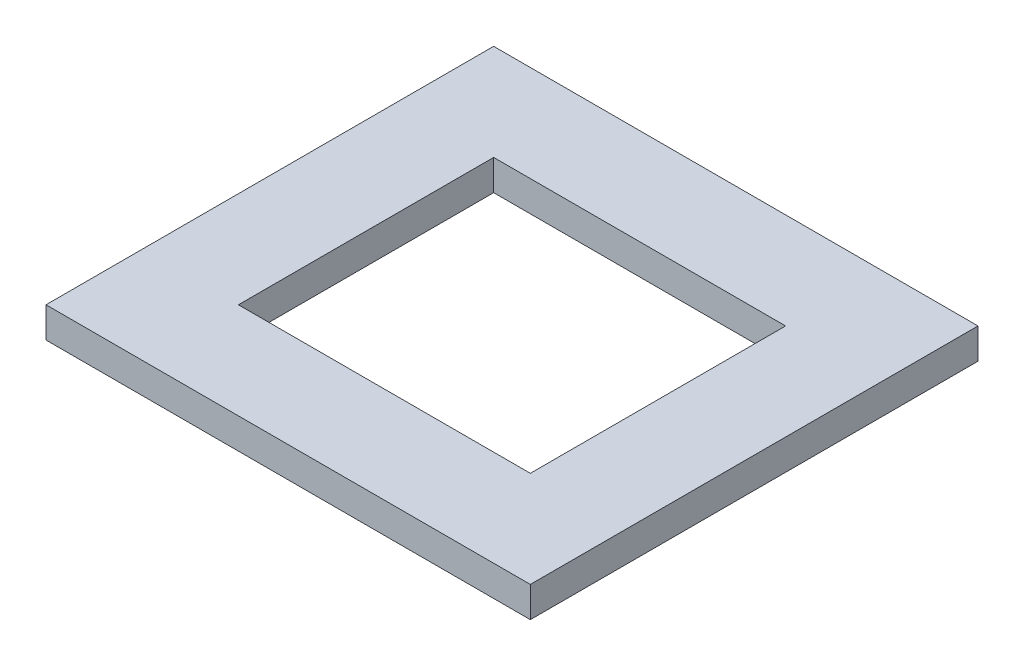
SolidWorks part; units mm, degrees
ref_plane "Front Plane" through (0, 0, 0) normal (0, 0, 1) x (1, 0, 0)
ref_plane "Top Plane" through (0, 0, 0) normal (0, 1, 0) x (1, 0, 0)
ref_plane "Right Plane" through (0, 0, 0) normal (1, 0, 0) x (0, 0, -1)
sketch "Sketch1" plane through (0, 0, 0) normal (0, 1, 0) x (1, 0, 0)
  line L1 (-68.265, 59.69) -> (68.265, 59.69)
  line L2 (-68.265, 59.69) -> (-68.265, -59.69)
  line L3 (-68.265, -59.69) -> (68.265, -59.69)
  line L4 (68.265, 59.69) -> (68.265, -59.69)
  line L5 (-68.265, 59.69) -> (68.265, -59.69) construction
  line L6 (-68.265, -59.69) -> (68.265, 59.69) construction
  line L7 (-113.265, 104.69) -> (113.265, 104.69)
  line L8 (-113.265, 104.69) -> (-113.265, -104.69)
  line L9 (-113.265, -104.69) -> (113.265, -104.69)
  line L10 (113.265, 104.69) -> (113.265, -104.69)
  line L11 (-113.265, 104.69) -> (113.265, -104.69) construction
  line L12 (-113.265, -104.69) -> (113.265, 104.69) construction
  point P0 (0, 0)
  point P6 (0, 0)
  dimension "D1" = 136.53
  dimension "D2" = 119.38
  dimension "D3" = 45
  dimension "D4" = 45
extrude "Boss-Extrude1" add sketch "Sketch1" along normal mid plane 14.29
sketch "Sketch2" plane through (0, 7.145, 0) normal (0, 1, 0) x (1, 0, 0)
  line L4 (93.665, -85.09) -> (-93.665, -85.09)
  line L5 (93.665, -85.09) -> (93.665, 85.09)
  line L6 (93.665, 85.09) -> (-93.665, 85.09)
  line L7 (-93.665, -85.09) -> (-93.665, 85.09)
  line L8 (113.265, -104.69) -> (113.265, 104.69) construction
  line L9 (-113.265, -104.69) -> (113.265, -104.69) construction
  line L10 (113.265, 104.69) -> (-113.265, 104.69) construction
  line L11 (-113.265, 104.69) -> (-113.265, -104.69) construction
  line L12 (113.265, -104.69) -> (113.265, 104.69)
  line L13 (-113.265, -104.69) -> (113.265, -104.69)
  line L14 (113.265, 104.69) -> (-113.265, 104.69)
  line L15 (-113.265, 104.69) -> (-113.265, -104.69)
  dimension "D1" = 19.6
  dimension "D2" = 19.6
  dimension "D3" = 19.6
  dimension "D4" = 19.6
extrude "Boss-Extrude2" [suppressed] add sketch "Sketch2" along normal blind 1.59
sketch "Sketch3" [suppressed] plane through (0, 8.735, 0) normal (0, 1, 0) x (1, 0, 0)
  line L4 (-113.265, -104.69) -> (113.265, -104.69)
  line L5 (113.265, -104.69) -> (113.265, 104.69)
  line L6 (113.265, 104.69) -> (-113.265, 104.69)
  line L7 (-113.265, 104.69) -> (-113.265, -104.69)
  line L8 (-113.265, -104.69) -> (113.265, -104.69)
  line L9 (113.265, -104.69) -> (113.265, 104.69)
  line L10 (113.265, 104.69) -> (-113.265, 104.69)
  line L11 (-113.265, 104.69) -> (-113.265, -104.69)
  line L12 (-68.265, -59.69) -> (68.265, -59.69)
  line L13 (68.265, -59.69) -> (68.265, 59.69)
  line L14 (68.265, 59.69) -> (-68.265, 59.69)
  line L15 (-68.265, 59.69) -> (-68.265, -59.69)
  dimension "D2" = 45
  dimension "D3" = 45
  dimension "D4" = 45
  dimension "D5" = 45
  dimension "D1" = 0
extrude "Boss-Extrude3" [suppressed] add sketch "Sketch3" along normal blind 3.17
